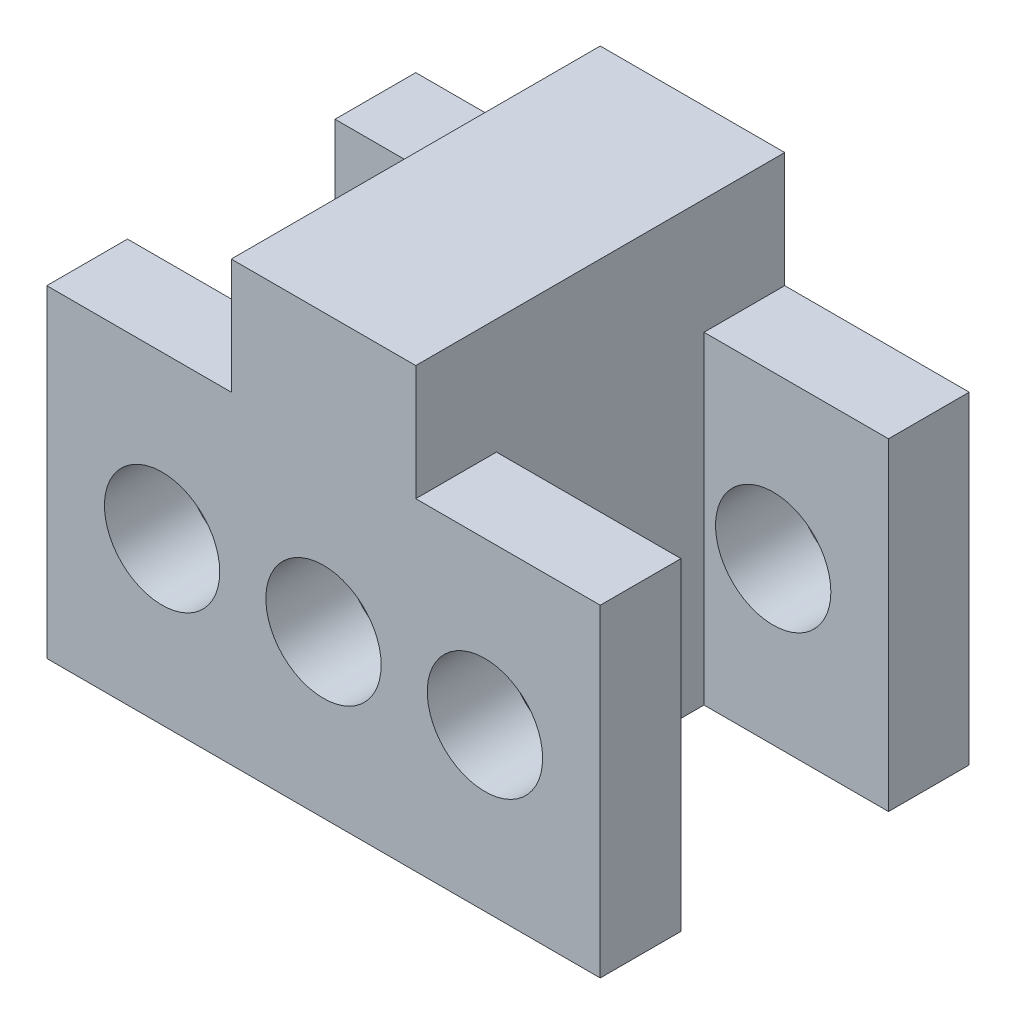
SolidWorks part; units mm, degrees
ref_plane "前视基准面" through (0, 0, 0) normal (0, 0, 1) x (1, 0, 0)
ref_plane "上视基准面" through (0, 0, 0) normal (0, 1, 0) x (1, 0, 0)
ref_plane "右视基准面" through (0, 0, 0) normal (1, 0, 0) x (0, 0, -1)
sketch "草图2" plane through (0, 0, 0) normal (0, 0, 1) x (1, 0, 0)
  line L0 (0, 0) -> (0, 60.2359) construction
  line L1 (-16, 28) -> (16, 28)
  line L5 (1.7048, 0) -> (70.7488, 0) construction
  line L6 (16, 28) -> (16, 48)
  line L7 (16, 48) -> (-16, 48)
  line L8 (-16, 48) -> (-16, 28)
extrude "拉伸1" add sketch "草图2" along normal mid plane 64
sketch "草图3" plane through (0, 0, 32) normal (0, 0, 1) x (1, 0, 0)
  line L0 (0, 0) -> (0, -36.4589) construction
  line L1 (-48, 28) -> (48, 28)
  line L2 (-48, 28) -> (-48, -28)
  line L3 (-48, -28) -> (48, -28)
  line L4 (48, 28) -> (48, -28)
  line L5 (0, -36.4589) -> (0, 0) construction
  line L6 (0, 0) -> (-71.265, 0) construction
  line L7 (-16, 28) -> (16, 28) construction
  circle A0 centre (0, 0) radius 10
  circle A1 centre (-28, 0) radius 10
  circle A2 centre (28, 0) radius 10
extrude "拉伸2" add sketch "草图3" against normal blind 14
mirror "镜向1" about plane through (0, 0, 0) normal (0, 0, 1) of "拉伸2"
sketch "草图4" plane through (0, -28, 0) normal (0, -1, 0) x (1, 0, 0)
  line L1 (-16, 18) -> (16, 18)
  line L2 (-16, 18) -> (-16, -18)
  line L3 (-16, -18) -> (16, -18)
  line L4 (16, 18) -> (16, -18)
extrude "拉伸3" add sketch "草图4" against normal up to next
